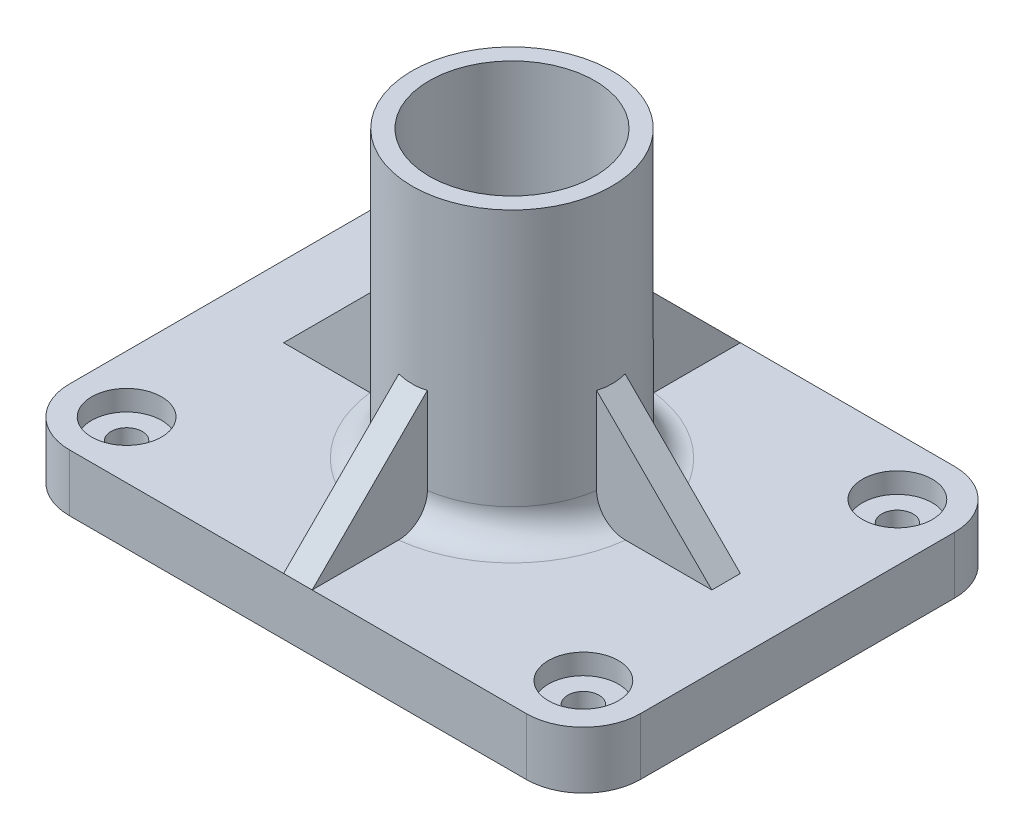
SolidWorks part; units mm, degrees
ref_plane "Front Plane" through (0, 0, 0) normal (0, 0, 1) x (1, 0, 0)
ref_plane "Top Plane" through (0, 0, 0) normal (0, 1, 0) x (1, 0, 0)
ref_plane "Right Plane" through (0, 0, 0) normal (1, 0, 0) x (0, 0, -1)
sketch "Sketch1" plane through (0, 0, 0) normal (0, 1, 0) x (1, 0, 0)
  line L0 (-50, 0) -> (50, 0) construction
  line L1 (-40, -37.5) -> (40, -37.5)
  line L2 (-50, -27.5) -> (-50, 27.5)
  line L3 (-40, 37.5) -> (40, 37.5)
  line L4 (50, -27.5) -> (50, 27.5)
  arc A0 (-40, 37.5) -> (-50, 27.5) centre (-40, 27.5) ccw
  arc A1 (50, 27.5) -> (40, 37.5) centre (40, 27.5) ccw
  arc A2 (50, -27.5) -> (40, -37.5) centre (40, -27.5) cw
  arc A3 (-50, -27.5) -> (-40, -37.5) centre (-40, -27.5) ccw
  point P13 (-50, -37.5)
  dimension "D1" = 10
  dimension "D2" = 75
  dimension "D3" = 100
extrude "Extrude1" add sketch "Sketch1" along normal blind 10
hole_wizard "CBORE for M5 Hex Head Bolt1" positions "Sketch3" profile "Sketch2" counterbore size "M5" standard "Ansi Metric"
sketch "Sketch3" plane through (0, 10, 0) normal (0, 1, 0) x (-1, 0, 0)
  point P0 (40, 27.5)
  point P1 (-40, -27.5)
  point P4 (-40, 27.5)
  point P7 (40, -27.5)
sketch "Sketch2" plane through (-40, 10, 27.5) normal (1, 0, 0) x (0, 0, 1)
  line L0 (0, 0) -> (0, 10)
  line L1 (0, 10) -> (2.75, 10)
  line L3 (2.75, 10) -> (2.75, 3.58)
  line L4 (2.75, 3.58) -> (6.12, 3.58)
  line L5 (6.12, 3.58) -> (6.12, 0)
  line L7 (6.12, 0) -> (0, 0)
  line L11 (0, -6.35) -> (0, 107.95) construction
  dimension "Thru Hole Dia." = 5.5
  dimension "Thru Hole Depth" = 10
  dimension "C'Bore Dia." = 12.24
  dimension "C'Bore Depth" = 3.58
sketch "Sketch4" plane through (0, 10, 0) normal (0, 1, 0) x (-1, 0, 0)
  line L0 (0, -37.5) -> (0, 37.5) construction
  line L1 (-40, -37.5) -> (40, -37.5) construction
  line L2 (40, 37.5) -> (-40, 37.5) construction
  circle A0 centre (0, 0) radius 17.5
  circle A1 centre (0, 0) radius 14.5
  dimension "D1" = 35
  dimension "D2" = 3
extrude "Extrude2" add sketch "Sketch4" along normal blind 50
sketch "Sketch5" plane through (0, 0, 0) normal (0, 0, 1) x (1, 0, 0)
  line L0 (37.5, 10) -> (17.5, 30)
  line L1 (-40, 10) -> (40, 10) construction
  line L2 (17.5, 10) -> (17.5, 60) construction
  dimension "D1" = 45
  dimension "D2" = 20
rib "Rib1" sketch "Sketch5" sketch "Sketch5" thickness 5 extrusion direction parallel to sketch draft on no parameters "D1"=5
pattern_circular "CirPattern1" count 4 over 360 about axis through (0, 0, 0) along (0, 1, 0) of "Rib1"
fillet "Fillet1" radius 5 4 edges at (-12.3744, 10, 12.3744) (-12.3744, 10, -12.3744) (12.3744, 10, -12.3744) (12.3744, 10, 12.3744)
